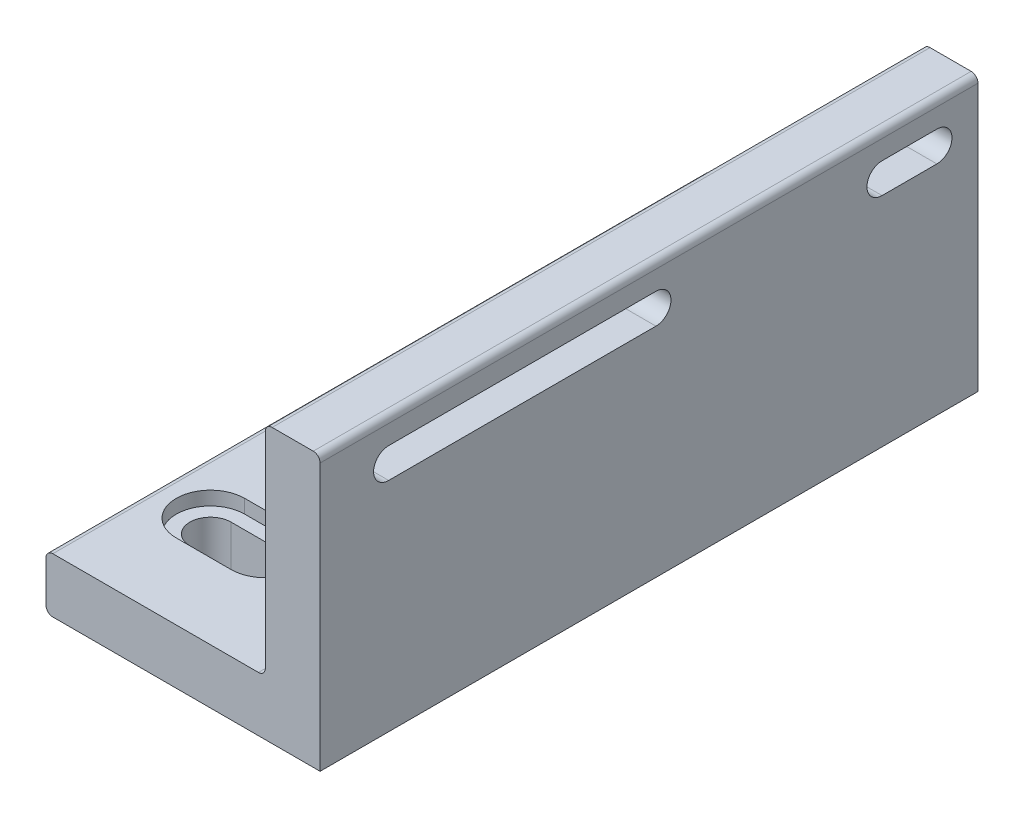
SolidWorks part; units mm, degrees
ref_plane "Front Plane" through (0, 0, 0) normal (0, 0, 1) x (1, 0, 0)
ref_plane "Top Plane" through (0, 0, 0) normal (0, 1, 0) x (1, 0, 0)
ref_plane "Right Plane" through (0, 0, 0) normal (1, 0, 0) x (0, 0, -1)
sketch "Sketch1" plane through (0, 0, 0) normal (0, 0, 1) x (1, 0, 0)
  line L0 (-28.575, 25.4) -> (-123.825, 25.4)
  line L3 (-127, 22.225) -> (-127, 3.175)
  line L4 (-123.825, 0) -> (0, 0)
  line L5 (-25.4, 28.575) -> (-25.4, 123.702)
  line L6 (-22.225, 126.877) -> (-3.175, 126.877)
  line L7 (0, 123.702) -> (0, 0)
  arc A1 (-25.4, 123.702) -> (-22.225, 126.877) centre (-22.225, 123.702) cw
  arc A2 (-28.575, 25.4) -> (-25.4, 28.575) centre (-28.575, 28.575) ccw
  arc A3 (-123.825, 0) -> (-127, 3.175) centre (-123.825, 3.175) cw
  arc A4 (-123.825, 25.4) -> (-127, 22.225) centre (-123.825, 22.225) ccw
  arc A6 (-3.175, 126.877) -> (0, 123.702) centre (-3.175, 123.702) cw
  point P4 (0, 0)
  point P5 (0, 0)
  point P17 (0, 0.2551)
  dimension "D1" = 25.4
  dimension "D2" = 126.877
  dimension "D3" = 25.4
  dimension "D4" = 127
extrude "Boss-Extrude1" add sketch "Sketch1" along normal mid plane 304.8
sketch "Sketch2" plane through (0, 0, 0) normal (1, 0, 0) x (0, 0, -1)
  line L0 (-120.65, 107.827) -> (133.35, 107.827) construction
  line L1 (-120.65, 114.812) -> (3.175, 114.812)
  line L2 (-120.65, 100.842) -> (3.175, 100.842)
  line L3 (107.95, 114.812) -> (133.35, 114.812)
  line L4 (-152.4, 126.877) -> (152.4, 126.877) construction
  line L5 (107.95, 100.842) -> (133.35, 100.842)
  arc A0 (-120.65, 114.812) -> (-120.65, 100.842) centre (-120.65, 107.827) ccw
  arc A1 (133.35, 100.842) -> (133.35, 114.812) centre (133.35, 107.827) ccw
  arc A2 (3.175, 114.812) -> (3.175, 100.842) centre (3.175, 107.827) cw
  arc A3 (107.95, 114.812) -> (107.95, 100.842) centre (107.95, 107.827) ccw
  point P2 (-67.8008, 86.7238)
  dimension "D2" = 6.985
  dimension "D7" = 104.775
  dimension "D1" = 19.05
  dimension "D3" = 254
  dimension "D4" = 120.65
  dimension "D6" = 25.4
extrude "Cut-Extrude1" cut sketch "Sketch2" against normal through all
sketch "Sketch3" plane through (0, 25.4, 0) normal (0, 1, 0) x (1, 0, 0)
  line L0 (0, 0) -> (-142.699, 0) construction
  line L1 (-101.6, 101.6) -> (-76.2, 101.6) construction
  line L2 (-101.6, 111.125) -> (-76.2, 111.125)
  line L3 (-101.6, 92.075) -> (-76.2, 92.075)
  line L4 (-127, -152.4) -> (-127, 152.4) construction
  line L5 (-101.6, -101.6) -> (-76.2, -101.6) construction
  line L6 (-101.6, -111.125) -> (-76.2, -111.125)
  line L7 (-101.6, -92.075) -> (-76.2, -92.075)
  arc A0 (-101.6, 111.125) -> (-101.6, 92.075) centre (-101.6, 101.6) ccw
  arc A1 (-76.2, 92.075) -> (-76.2, 111.125) centre (-76.2, 101.6) ccw
  arc A2 (-101.6, -111.125) -> (-101.6, -92.075) centre (-101.6, -101.6) cw
  arc A3 (-76.2, -92.075) -> (-76.2, -111.125) centre (-76.2, -101.6) cw
  point P5 (-88.9, 101.6)
  point P14 (-88.9, -101.6)
  dimension "D1" = 25.4
  dimension "D2" = 19.05
  dimension "D3" = 25.4
  dimension "D4" = 101.6
extrude "Cut-Extrude2" cut sketch "Sketch3" against normal through all
sketch "Sketch4" plane through (0, 25.4, 0) normal (0, 1, 0) x (1, 0, 0)
  line L4 (-101.6, 85.725) -> (-76.2, 85.725)
  line L5 (-76.2, 117.475) -> (-101.6, 117.475)
  line L6 (-101.6, 85.725) -> (-76.2, 85.725)
  line L7 (-76.2, 117.475) -> (-101.6, 117.475)
  line L10 (-101.6, -117.475) -> (-76.2, -117.475)
  line L11 (-76.2, -85.725) -> (-101.6, -85.725)
  line L12 (-101.6, -117.475) -> (-76.2, -117.475)
  line L13 (-76.2, -85.725) -> (-101.6, -85.725)
  arc A4 (-101.6, 117.475) -> (-101.6, 85.725) centre (-101.6, 101.6) ccw
  arc A5 (-76.2, 85.725) -> (-76.2, 117.475) centre (-76.2, 101.6) ccw
  arc A6 (-101.6, 117.475) -> (-101.6, 85.725) centre (-101.6, 101.6) ccw
  arc A7 (-76.2, 85.725) -> (-76.2, 117.475) centre (-76.2, 101.6) ccw
  arc A10 (-101.6, -85.725) -> (-101.6, -117.475) centre (-101.6, -101.6) ccw
  arc A11 (-76.2, -117.475) -> (-76.2, -85.725) centre (-76.2, -101.6) ccw
  arc A12 (-101.6, -85.725) -> (-101.6, -117.475) centre (-101.6, -101.6) ccw
  arc A13 (-76.2, -117.475) -> (-76.2, -85.725) centre (-76.2, -101.6) ccw
  dimension "D1" = 6.35
  dimension "D2" = 6.35
extrude "Cut-Extrude3" cut sketch "Sketch4" against normal blind 6.35
